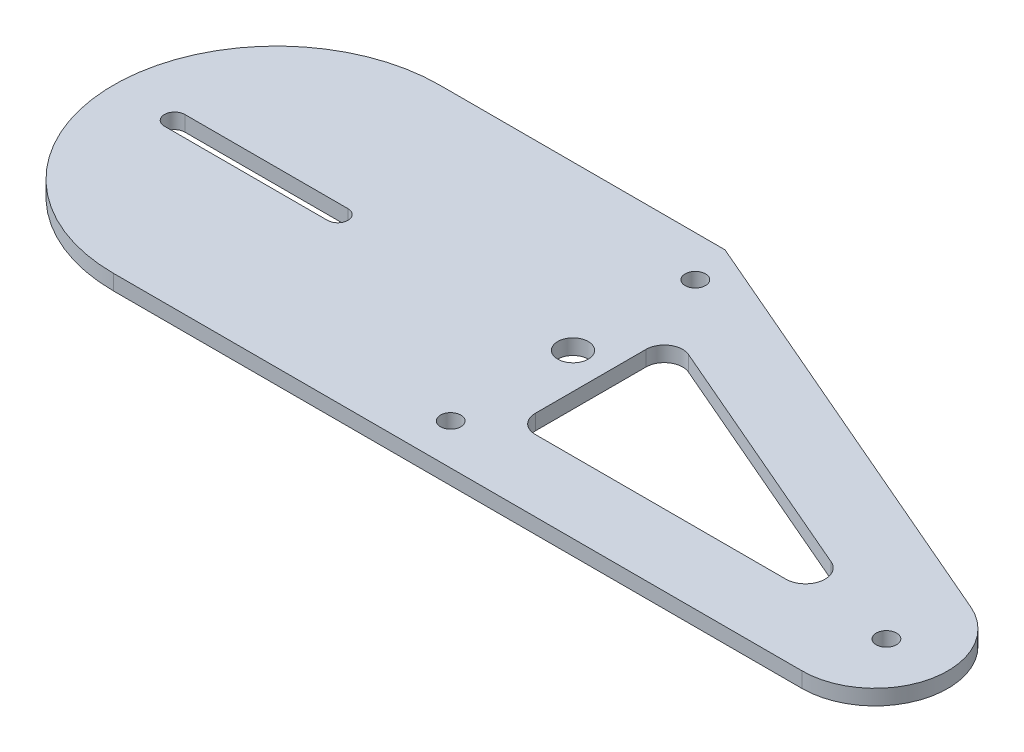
SolidWorks part; units mm, degrees
ref_plane "Front Plane" through (0, 0, 0) normal (0, 0, 1) x (1, 0, 0)
ref_plane "Top Plane" through (0, 0, 0) normal (0, 1, 0) x (1, 0, 0)
ref_plane "Right Plane" through (0, 0, 0) normal (1, 0, 0) x (0, 0, -1)
sketch "Sketch1" plane through (0, 0, 0) normal (0, 1, 0) x (1, 0, 0)
  line L0 (0, 133.35) -> (0, -19.05) construction
  line L1 (33.655, 0) -> (189.7981, 0)
  line L2 (-184.7027, -44.45) -> (244.3637, -44.45)
  line L3 (201.7502, 9.7364) -> (288.8137, -8.2403) construction
  line L4 (22.225, 80.3988) -> (22.225, 11.43)
  line L5 (-22.225, 57.15) -> (22.225, 57.15) construction
  line L6 (194.6318, 23.4103) -> (38.1821, 90.8941)
  line L7 (116.407, 57.1522) -> (134.0122, 97.9671) construction
  line L9 (262.3403, 42.6135) -> (-6.3008, 158.4904)
  line L11 (117.4193, 0) -> (117.4193, -44.45) construction
  line L12 (262.3403, 42.6135) -> (244.3637, -44.45) construction
  line L13 (-7.5583, 158.75) -> (-184.7027, 158.75)
  line L14 (-248.2027, 63.5) -> (-146.6027, 63.5)
  line L15 (-248.2027, 50.8) -> (-146.6027, 50.8)
  line L16 (-184.7027, 63.5) -> (-184.7027, 50.8) construction
  circle A0 centre (0, 133.35) radius 6.35
  circle A1 centre (0, -19.05) radius 6.35
  circle A2 centre (0, 57.15) radius 9.525
  arc A3 (-184.7027, 158.75) -> (-184.7027, -44.45) centre (-184.7027, 57.15) ccw
  arc A4 (38.1821, 90.8941) -> (22.225, 80.3988) centre (33.655, 80.3988) ccw
  arc A6 (-248.2027, 63.5) -> (-248.2027, 50.8) centre (-248.2027, 57.15) ccw
  arc A7 (262.3403, 42.6135) -> (244.3637, -44.45) centre (244.3637, 0.9376) cw
  arc A8 (-146.6027, 63.5) -> (-146.6027, 50.8) centre (-146.6027, 57.15) cw
  arc A9 (22.225, 11.43) -> (33.655, 0) centre (33.655, 11.43) ccw
  circle A10 centre (253.352, -0.9183) radius 6.35
  arc A11 (194.6318, 23.4103) -> (189.7981, 0) centre (189.7981, 12.2042) cw
  arc A12 (-6.3008, 158.4904) -> (-7.5583, 158.75) centre (-7.5583, 155.575) ccw
  point P9 (245.2819, 0.748)
  point P35 (22.225, 0)
  point P46 (-6.9027, 158.75)
  dimension "D3" = 12.7
  dimension "D5" = 19.05
  dimension "D6" = 177.8
  dimension "D10" = 88.9
  dimension "D11" = 45.3876
  dimension "D9" = 101.6
  dimension "D12" = 117.4193
  dimension "D13" = 12.7
  dimension "D14" = 63.5
  dimension "D15" = 12.7
  dimension "D7" = 203.2
  dimension "D16" = 11.43
  dimension "D17" = 3.175
  dimension "D2" = 44.45
  dimension "D4" = 152.4
  dimension "D8" = 254
extrude "Extrude1" add sketch "Sketch1" along normal blind 9.525
sketch "Sketch2" plane through (0, 9.525, 0) normal (0, 1, 0) x (1, 0, 0)
  line L0 (0, -44.45) -> (0, 155.7725) construction
  line L1 (-184.7027, -44.45) -> (244.3637, -44.45) construction
  line L2 (262.3403, 42.6135) -> (-6.3008, 158.4904) construction
equation "\"D10@Sketch1\" = 2*\"D2@Sketch1\""
